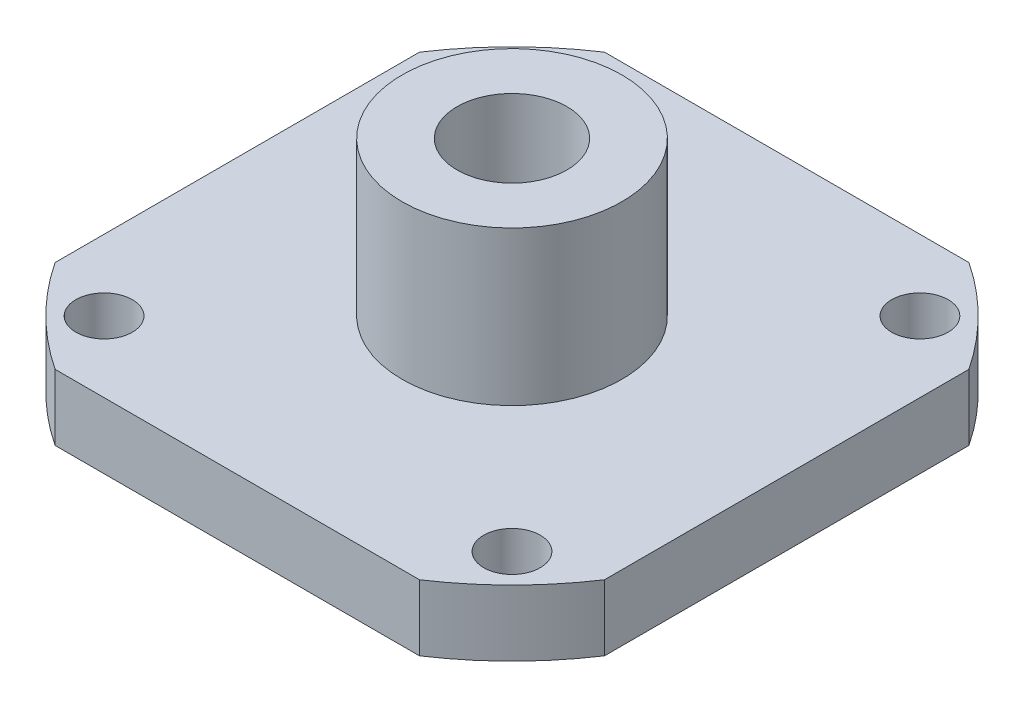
SolidWorks part; units mm, degrees
ref_plane "Front Plane" through (0, 0, 0) normal (0, 0, 1) x (1, 0, 0)
ref_plane "Top Plane" through (0, 0, 0) normal (0, 1, 0) x (1, 0, 0)
ref_plane "Right Plane" through (0, 0, 0) normal (1, 0, 0) x (0, 0, -1)
sketch "Sketch1" plane through (0, 0, 0) normal (0, 0, 1) x (1, 0, 0)
  line L0 (0, 0) -> (0, 30.3693) construction
  line L1 (-3.175, 0) -> (-3.175, 12.7)
  line L2 (-3.175, 12.7) -> (-6.35, 12.7)
  line L3 (-6.35, 3.81) -> (-19.05, 3.81)
  line L4 (-19.05, 3.81) -> (-19.05, 0)
  line L5 (-19.05, 0) -> (-13.4426, 0)
  line L6 (-9.9762, 0) -> (-10.1372, 1.8399)
  line L7 (-10.2637, 1.9558) -> (-13.1551, 1.9558)
  line L8 (-13.2816, 1.8399) -> (-13.4426, 0)
  line L9 (-9.9762, 0) -> (-3.175, 0)
  line L10 (-13.2715, 1.9558) -> (-13.2715, -0.6662) construction
  line L12 (-6.35, 3.81) -> (-6.35, 12.7)
  arc A0 (-13.1551, 1.9558) -> (-13.2816, 1.8399) centre (-13.1551, 1.8288) ccw
  arc A1 (-10.1372, 1.8399) -> (-10.2637, 1.9558) centre (-10.2637, 1.8288) ccw
  point P19 (-10.1473, 1.9558)
  dimension "D11" = 0.127
  dimension "D1" = 20.2946
  dimension "D2" = 12.7
  dimension "D3" = 1.9558
  dimension "D4" = 3.81
  dimension "D5" = 3.1242
  dimension "D6" = 6.35
  dimension "D7" = 12.7
  dimension "D8" = 19.05
  dimension "D9" = 5
  dimension "D10" = 5
revolve "Revolve1" add sketch "Sketch1" angle 360 about L0
hole_wizard "#4 Clearance Hole1" positions "Sketch3" profile "Sketch4" hole size "#4" standard "Ansi Inch"
sketch "Sketch3" plane through (0, 3.81, 0) normal (0, 1, 0) x (-1, 0, 0)
  line L3 (0, 0) -> (11.7866, 11.7866) construction
  line L8 (0, 0) -> (-11.7866, 11.7866) construction
  line L9 (0, 0) -> (11.7866, -11.7866) construction
  line L12 (0, 0) -> (-11.7866, -11.7866) construction
  circle A0 centre (0, 0) radius 16.6687 construction
  point P0 (11.7866, -11.7866)
  point P1 (11.7866, 11.7866)
  point P3 (-11.7866, 11.7866)
  point P31 (-11.7866, -11.7866)
  dimension "D1" = 33.3375
  dimension "D2" = 90
  dimension "D3" = 90
  dimension "D4" = 90
sketch "Sketch4" plane through (-11.7866, 3.81, -11.7866) normal (1, 0, 0) x (0, 0, 1)
  line L0 (0, 0) -> (0, 3.81)
  line L1 (0, 3.81) -> (1.6319, 3.81)
  line L2 (1.6319, 3.81) -> (1.6319, 0)
  line L5 (1.6319, 0) -> (0, 0)
  line L11 (0, -6.35) -> (0, 107.95) construction
  dimension "Thru Hole Dia." = 3.2639
  dimension "Thru Hole Depth" = 3.81
sketch "Sketch5" plane through (0, 3.81, 0) normal (0, 1, 0) x (1, 0, 0)
  line L0 (0, 15.875) -> (0, 0) construction
  line L1 (-15.875, 15.875) -> (15.875, 15.875)
  line L2 (-15.875, 15.875) -> (-15.875, -15.875)
  line L3 (-15.875, -15.875) -> (15.875, -15.875)
  line L4 (15.875, 15.875) -> (15.875, -15.875)
  line L5 (0, 0) -> (0, -15.875) construction
  dimension "D1" = 31.75
extrude "Cut-Extrude1" cut sketch "Sketch5" against normal through all flip side to cut
